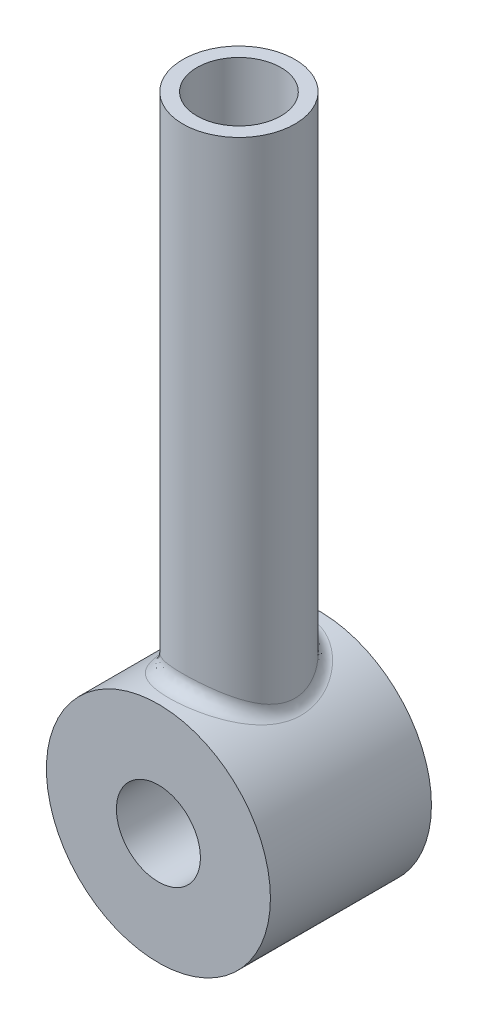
SolidWorks part; units mm, degrees
ref_plane "Face" through (0, 0, 0) normal (0, 0, 1) x (1, 0, 0)
ref_plane "Dessus" through (0, 0, 0) normal (0, 1, 0) x (1, 0, 0)
ref_plane "Droite" through (0, 0, 0) normal (1, 0, 0) x (0, 0, -1)
sketch "Esquisse1" plane through (0, 0, 0) normal (0, 0, 1) x (1, 0, 0)
  circle A0 centre (0, 0) radius 8
  dimension "D1" = 16
extrude "Base-Extrusion" add sketch "Esquisse1" along normal blind 11.5
sketch "Esquisse2" plane through (0, 0, 0) normal (0, 1, 0) x (1, 0, 0)
  line L0 (0, -11.5) -> (0, 0) construction
  line L1 (0, 0) -> (0, -5.75) construction
  line L2 (0, -5.75) -> (0, -11.5) construction
  line L3 (-8, -11.5) -> (8, -11.5) construction
  circle A0 centre (0, -5.75) radius 4
  dimension "D1" = 8
extrude "Boss.-Extru.1" add sketch "Esquisse2" along normal blind 43
sketch "Esquisse3" plane through (0, 0, 11.5) normal (0, 0, 1) x (1, 0, 0)
  circle A0 centre (0, 0) radius 3
  dimension "D1" = 6
extrude "Enlèv. mat.-Extru.1" cut sketch "Esquisse3" against normal through all
fillet "Congé1" radius 1
sketch "Esquisse4" plane through (0, 43, 0) normal (0, 1, 0) x (-1, 0, 0)
  circle A0 centre (0, 5.75) radius 3
  circle A1 centre (0, 5.75) radius 4 construction
  dimension "D1" = 6
extrude "Enlèv. mat.-Extru.2" cut sketch "Esquisse4" against normal blind 10
